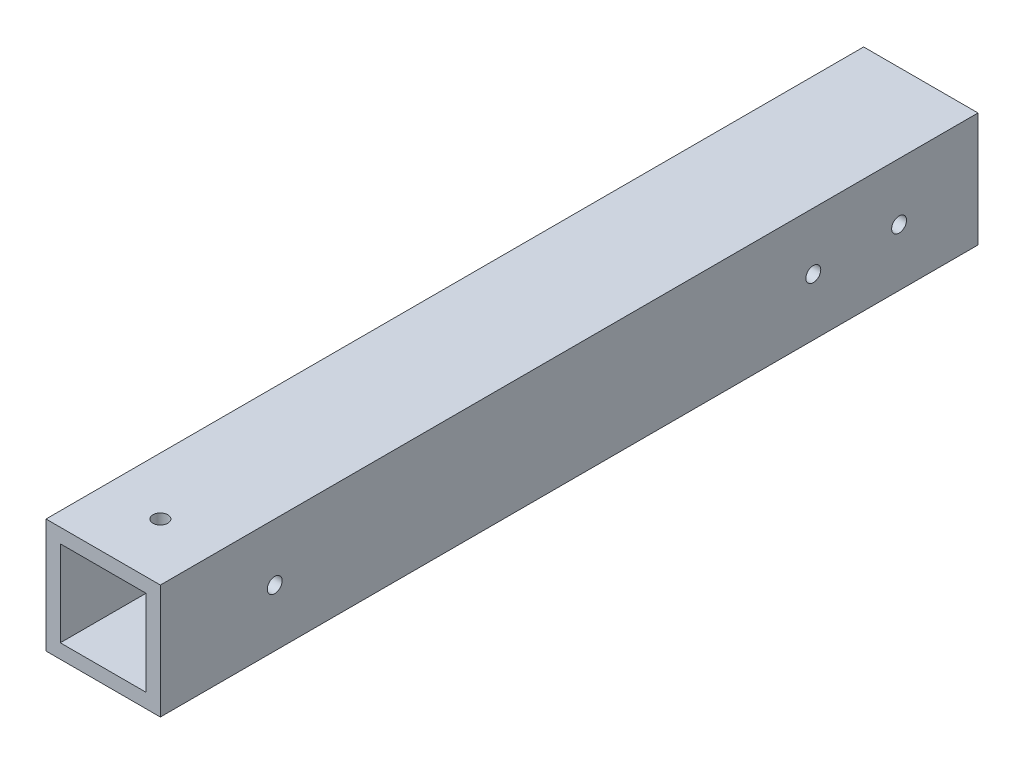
SolidWorks part; units mm, degrees
ref_plane "Front Plane" through (0, 0, 0) normal (0, 0, 1) x (1, 0, 0)
ref_plane "Top Plane" through (0, 0, 0) normal (0, 1, 0) x (1, 0, 0)
ref_plane "Right Plane" through (0, 0, 0) normal (1, 0, 0) x (0, 0, -1)
sketch "Sketch1" plane through (0, 0, 0) normal (0, 0, 1) x (1, 0, 0)
  line L1 (0, 0) -> (50.8, 0)
  line L2 (0, 0) -> (0, 50.8)
  line L3 (0, 50.8) -> (50.8, 50.8)
  line L4 (50.8, 0) -> (50.8, 50.8)
  line L5 (6.35, 6.35) -> (44.45, 6.35)
  line L6 (6.35, 6.35) -> (6.35, 44.45)
  line L7 (6.35, 44.45) -> (44.45, 44.45)
  line L8 (44.45, 6.35) -> (44.45, 44.45)
  dimension "D1" = 50.8
  dimension "D2" = 50.8
  dimension "D3" = 38.1
  dimension "D4" = 6.35
  dimension "D5" = 38.1
  dimension "D6" = 6.35
extrude "Boss-Extrude1" add sketch "Sketch1" against normal blind 363.22
sketch "Sketch3" plane through (0, 50.8, 0) normal (0, 1, 0) x (1, 0, 0)
  line L0 (50.8, 0) -> (0, 0) construction
  circle A0 centre (25.4, 25.4) radius 3.302
  dimension "D1" = 6.604
  dimension "D2" = 25.4
extrude "hold down" cut sketch "Sketch3" against normal through all
sketch "Sketch4" plane through (50.8, 0, 0) normal (1, 0, 0) x (0, 0, -1)
  line L0 (0, 44.45) -> (0, 6.35) construction
  line L1 (0, 0) -> (0, 50.8) construction
  circle A0 centre (50.8, 25.4) radius 3.302
  circle A1 centre (290.068, 25.4) radius 3.302
  circle A2 centre (328.168, 25.4) radius 3.302
  point P6 (0, 25.4)
  dimension "D1" = 6.604
  dimension "D2" = 50.8
  dimension "D3" = 290.068
  dimension "D4" = 38.1
extrude "Cut-Extrude1" cut sketch "Sketch4" against normal through all
